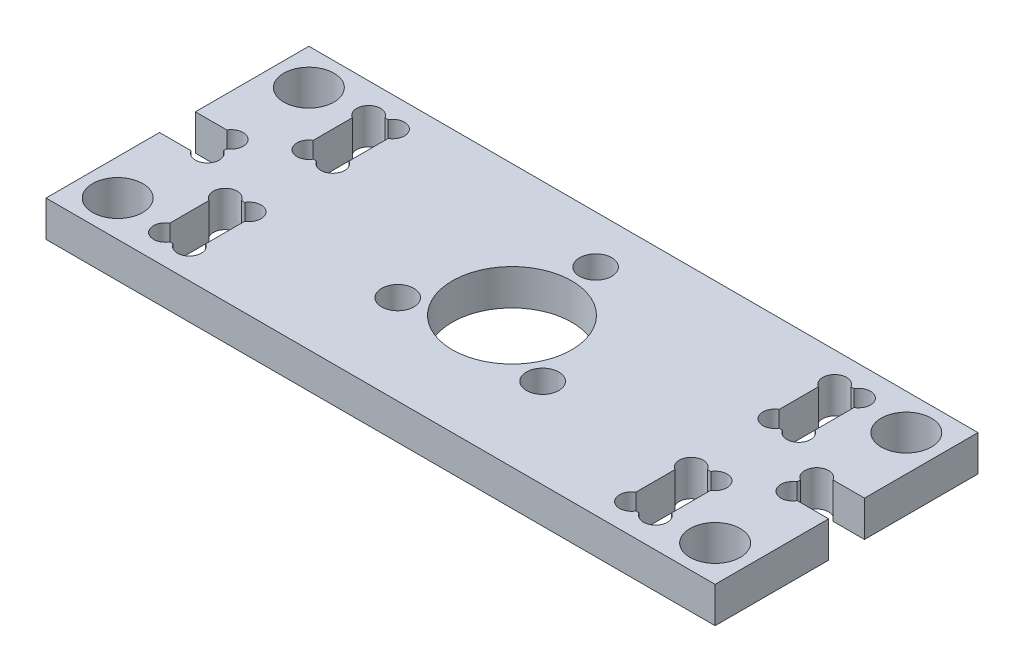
SolidWorks part; units mm, degrees
ref_plane "前视基准面" through (0, 0, 0) normal (0, 0, 1) x (1, 0, 0)
ref_plane "上视基准面" through (0, 0, 0) normal (0, 1, 0) x (1, 0, 0)
ref_plane "右视基准面" through (0, 0, 0) normal (1, 0, 0) x (0, 0, -1)
sketch "草图1" plane through (0, 0, 0) normal (0, 1, 0) x (1, 0, 0)
  line L1 (-28, -11) -> (28, -11)
  line L2 (-28, -11) -> (-28, 11)
  line L3 (-28, 11) -> (28, 11)
  line L4 (28, -11) -> (28, 11)
  line L5 (-28, -11) -> (28, 11) construction
  line L6 (-28, 11) -> (28, -11) construction
  point P0 (0, 0)
  dimension "D1" = 22
  dimension "D2" = 56
extrude "凸台-拉伸1" add sketch "草图1" along normal blind 3
hole_wizard "Ø4.2 (4.2) 直径孔1" positions "草图2" profile "草图3" hole size "Ø4.2" standard "GB"
sketch "草图2" plane through (0, 3, 0) normal (0, 1, 0) x (1, 0, 0)
  line L0 (0, 11) -> (0, -11) construction
  line L1 (28, 11) -> (-28, 11) construction
  line L2 (-28, -11) -> (28, -11) construction
  line L4 (-28, 0) -> (28, 0) construction
  line L5 (-28, 11) -> (-28, -11) construction
  line L6 (28, -11) -> (28, 11) construction
  point P16 (-25, 8)
  point P19 (25, 8)
  point P20 (25, -8)
  point P21 (-25, -8)
  dimension "D1" = 50
  dimension "D2" = 16
sketch "草图3" plane through (-25, 3, 8) normal (1, 0, 0) x (0, 0, 1)
  line L0 (0, 0) -> (0, 3)
  line L1 (0, 3) -> (2.1, 3)
  line L2 (2.1, 3) -> (2.1, 0)
  line L5 (2.1, 0) -> (0, 0)
  line L11 (0, -6.35) -> (0, 107.95) construction
  dimension "通孔孔直径" = 4.2
  dimension "通孔孔深度" = 3
sketch "草图4" plane through (0, 3, 0) normal (0, 1, 0) x (1, 0, 0)
  circle A0 centre (0, 0) radius 5
  dimension "D1" = 10
extrude "切除-拉伸1" cut sketch "草图4" against normal through all
sketch "草图5" plane through (0, 3, 0) normal (0, 1, 0) x (1, 0, 0)
  line L0 (0, 11) -> (0, -11) construction
  line L1 (28, 11) -> (-28, 11) construction
  line L2 (-28, -11) -> (28, -11) construction
  line L3 (-28, 0) -> (28, 0) construction
  line L4 (-21, 9) -> (-18, 9)
  line L5 (-21, 9) -> (-21, 3)
  line L6 (-21, 3) -> (-18, 3)
  line L7 (-18, 9) -> (-18, 3)
  line L8 (-28, 11) -> (-28, -11) construction
  line L9 (28, -11) -> (28, 11) construction
  line L10 (-18, -9) -> (-18, -3)
  line L11 (-21, -3) -> (-18, -3)
  line L12 (-21, -9) -> (-21, -3)
  line L13 (-21, -9) -> (-18, -9)
  line L14 (21, -9) -> (18, -9)
  line L15 (21, -9) -> (21, -3)
  line L16 (21, -3) -> (18, -3)
  line L17 (18, -9) -> (18, -3)
  line L18 (18, 9) -> (18, 3)
  line L19 (21, 3) -> (18, 3)
  line L20 (21, 9) -> (21, 3)
  line L21 (21, 9) -> (18, 9)
  line L22 (24, 1.5) -> (24, -1.5)
  line L23 (-28, 1.5) -> (-24, 1.5)
  line L24 (-28, 1.5) -> (-28, -1.5)
  line L25 (-28, -1.5) -> (-24, -1.5)
  line L26 (-24, 1.5) -> (-24, -1.5)
  line L27 (28, -1.5) -> (24, -1.5)
  line L28 (28, 1.5) -> (28, -1.5)
  line L29 (28, 1.5) -> (24, 1.5)
  dimension "D1" = 6
  dimension "D2" = 6
  dimension "D3" = 7
  dimension "D4" = 3
  dimension "D5" = 3
  dimension "D6" = 4
extrude "切除-拉伸2" cut sketch "草图5" against normal through all
hole_wizard "Ø2.0 (2) 直径孔1" positions "草图6" profile "草图7" hole size "Ø2.0" standard "GB"
sketch "草图6" plane through (0, 3, 0) normal (0, 1, 0) x (1, 0, 0)
  line L0 (-18, 9) -> (-21, 9) construction
  line L1 (-21, 9) -> (-21, 3) construction
  line L2 (-21, 6) -> (-18, 6) construction
  line L3 (-18, 3) -> (-18, 9) construction
  line L5 (-19.5, 9) -> (-19.5, 3) construction
  line L6 (-21, 3) -> (-18, 3) construction
  line L7 (-24, 1.5) -> (-28, 1.5) construction
  line L8 (-24, -1.5) -> (-24, 1.5) construction
  line L9 (-24, 0) -> (24, 0) construction
  line L10 (24, 1.5) -> (24, -1.5) construction
  line L12 (0, 11) -> (0, -11) construction
  line L13 (28, 11) -> (-28, 11) construction
  line L14 (-28, -11) -> (28, -11) construction
  point P2 (-20.5, 8.5)
  point P21 (-18.5, 8.5)
  point P23 (-18.5, 3.5)
  point P24 (-20.5, 3.5)
  point P25 (-24.5, 1)
  point P46 (-24.5, -1)
  point P47 (-20.5, -3.5)
  point P48 (-18.5, -3.5)
  point P49 (-18.5, -8.5)
  point P50 (-20.5, -8.5)
  point P51 (20.5, -8.5)
  point P52 (18.5, -8.5)
  point P53 (18.5, -3.5)
  point P54 (20.5, -3.5)
  point P55 (24.5, -1)
  point P56 (24.5, 1)
  point P57 (20.5, 3.5)
  point P58 (18.5, 3.5)
  point P59 (18.5, 8.5)
  point P60 (20.5, 8.5)
  dimension "D1" = 0.5
  dimension "D2" = 0.5
  dimension "D3" = 0.5
  dimension "D4" = 0.5
sketch "草图7" plane through (-20.5, 3, -8.5) normal (1, 0, 0) x (0, 0, 1)
  line L0 (0, 0) -> (0, 3)
  line L1 (0, 3) -> (1, 3)
  line L2 (1, 3) -> (1, 0)
  line L5 (1, 0) -> (0, 0)
  line L11 (0, -6.35) -> (0, 107.95) construction
  dimension "通孔孔直径" = 2
  dimension "通孔孔深度" = 3
hole_wizard "Ø2.7 (2.7) 直径孔1" positions "草图8" profile "草图9" hole size "Ø2.7" standard "GB"
sketch "草图8" plane through (0, 3, 0) normal (0, 1, 0) x (1, 0, 0)
  circle A0 centre (0, 0) radius 7 construction
  point P5 (0, 7)
  point P11 (6.0622, -3.5)
  point P12 (-6.0622, -3.5)
  point P13 (0, 0)
  dimension "D1" = 14
  dimension "D2" = 3
sketch "草图9" plane through (0, 3, 0) normal (1, 0, 0) x (0, 0, 1)
  line L0 (0, 0) -> (0, 3)
  line L1 (0, 3) -> (1.35, 3)
  line L2 (1.35, 3) -> (1.35, 0)
  line L5 (1.35, 0) -> (0, 0)
  line L11 (0, -6.35) -> (0, 107.95) construction
  dimension "通孔孔直径" = 2.7
  dimension "通孔孔深度" = 3
